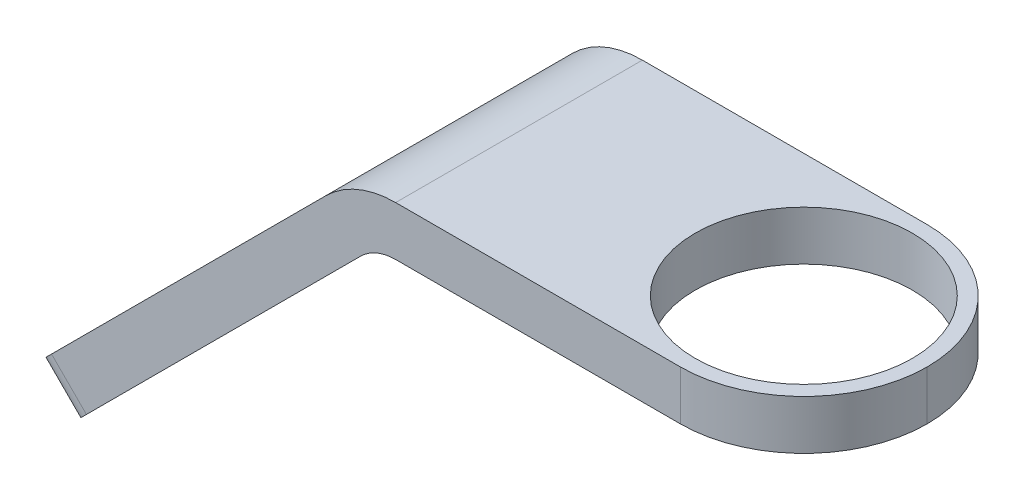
SolidWorks part; units mm, degrees
ref_plane "Plan de face" through (0, 0, 0) normal (0, 0, 1) x (1, 0, 0)
ref_plane "Plan de dessus" through (0, 0, 0) normal (0, 1, 0) x (1, 0, 0)
ref_plane "Plan de droite" through (0, 0, 0) normal (1, 0, 0) x (0, 0, -1)
sketch "Esquisse1" plane through (0, 0, 0) normal (0, 0, 1) x (1, 0, 0)
  line L0 (0, 0) -> (65, 65)
  line L1 (156, 65) -> (65, 65)
  line L2 (7.0711, -7.0711) -> (69.1421, 55)
  line L3 (156, 55) -> (69.1421, 55)
  line L4 (0, 0) -> (7.0711, -7.0711)
  line L5 (156, 65) -> (156, 55)
  dimension "D2" = 91
  dimension "D3" = 135
  dimension "D4" = 65
  dimension "D1" = 10
extrude "Boss.-Extru.1" add sketch "Esquisse1" along normal blind 50
fillet "Congé1" radius 25 2 edges at (156, 60, 0) (156, 60, 50)
sketch "Esquisse2" plane through (0, 65, 0) normal (0, 1, 0) x (1, 0, 0)
  line L0 (131, 0) -> (65, 0) construction
  circle A0 centre (131, -25) radius 22
  dimension "D1" = 44
  dimension "D2" = 25
  dimension "D3" = 25
extrude "Enlèv. mat.-Extru.1" cut sketch "Esquisse2" against normal through all
fillet "Congé2" radius 20 1 edges at (65, 65, 25)
fillet "Congé3" radius 10 1 edges at (69.1421, 55, 25)
fillet "Congé4" radius 5 2 edges at (3.5355, -3.5355, 0) (3.5355, -3.5355, 50)
